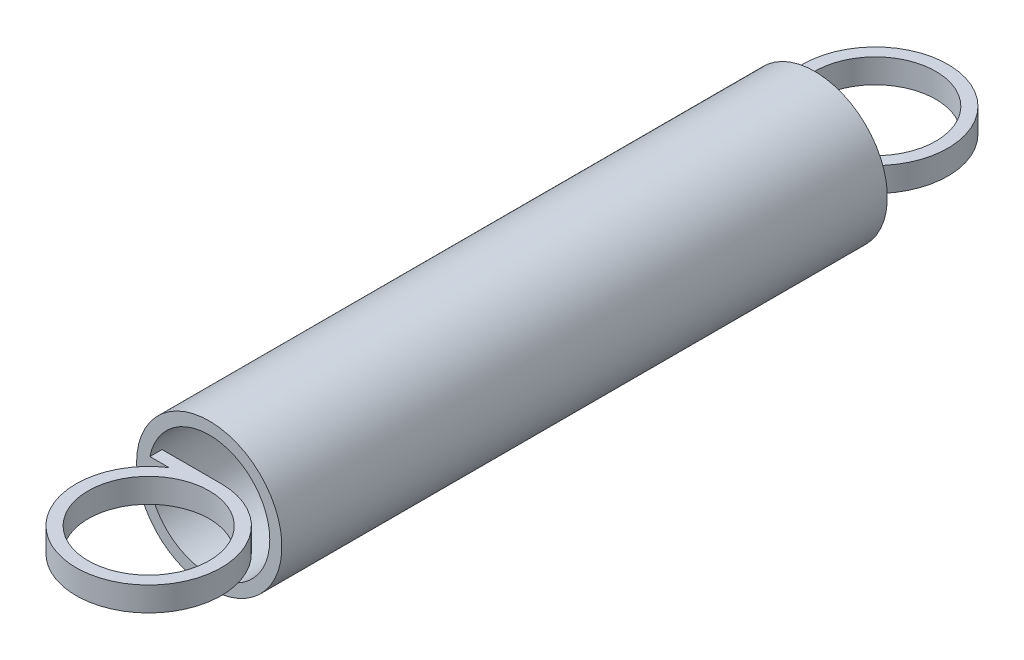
SolidWorks part; units mm, degrees
ref_plane "X" through (0, 0, 0) normal (0, 0, 1) x (1, 0, 0)
ref_plane "Y" through (0, 0, 0) normal (0, 1, 0) x (1, 0, 0)
ref_plane "Z" through (0, 0, 0) normal (1, 0, 0) x (0, 0, -1)
sketch "Esquisse1" plane through (0, 0, 0) normal (0, 0, 1) x (1, 0, 0)
  circle A0 centre (0, 0) radius 3
  dimension "D1" = 6
extrude "Base-Extru.-Mince" add sketch "Esquisse1" along normal mid plane 25 thin
sketch "Esquisse2" plane through (0, 0, 0) normal (0, 1, 0) x (1, 0, 0)
  line L0 (0, -12.5) -> (0, 12.5) construction
  line L1 (3, 12.5) -> (-3, 12.5) construction
  line L3 (3, 12) -> (-3, 12)
  line L4 (0, 12) -> (-2.7, 12)
  line L6 (-1.6583, 12.5) -> (-2.7, 12.5)
  line L7 (-2.7, 12.5) -> (-2.7, -12.5)
  line L8 (-2.7, 12.5) -> (-2.7, 12)
  arc A0 (0, 12) -> (-1.6583, 12.5) centre (0, 15) ccw
  circle A1 centre (0, 15) radius 2.5
  dimension "D1" = 6
  dimension "D5" = 5
  dimension "D2" = 2.5
  dimension "D3" = 0.5
  dimension "D4" = 0.2
extrude "Boss.-Extru.1" add sketch "Esquisse2" along normal mid plane 1
mirror "Symétrie1" about plane through (0, 0, 0) normal (0, 0, 1)
